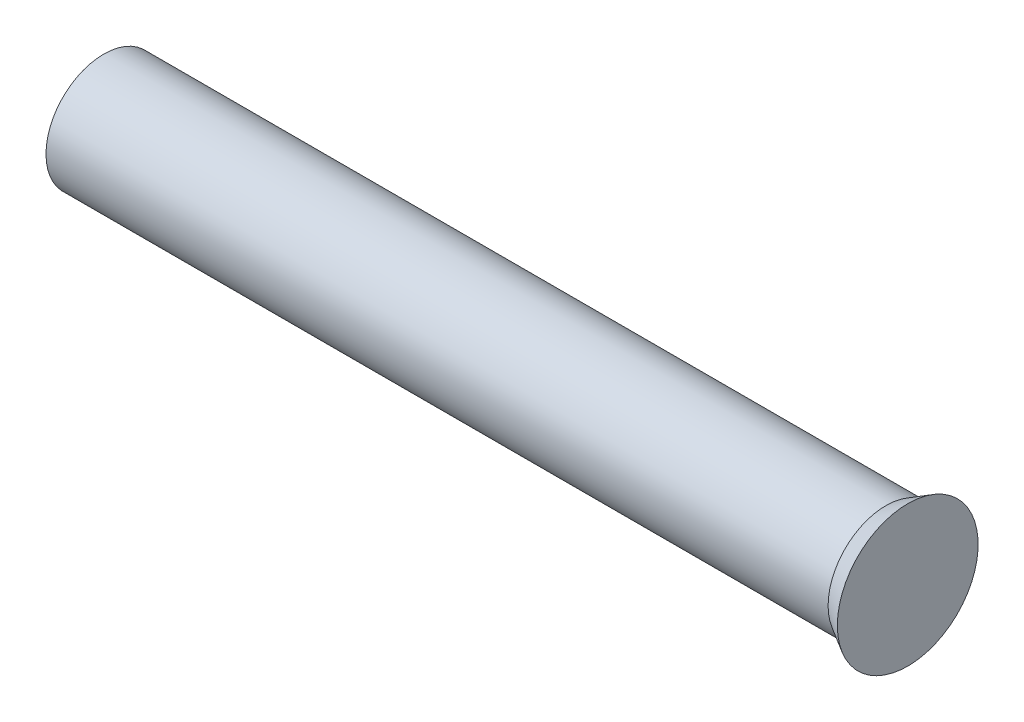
SolidWorks part; units mm, degrees
ref_plane "Front Plane" through (0, 0, 0) normal (0, 0, 1) x (1, 0, 0)
ref_plane "Top Plane" through (0, 0, 0) normal (0, 1, 0) x (1, 0, 0)
ref_plane "Right Plane" through (0, 0, 0) normal (1, 0, 0) x (0, 0, -1)
sketch "Sketch1" plane through (0, 0, 0) normal (0, 0, 1) x (1, 0, 0)
  line L0 (0, 0) -> (19.812, 0)
  line L1 (19.812, 0) -> (19.812, 1.702)
  line L2 (0, 0) -> (0, 1.397) construction
  line L3 (19.812, 1.702) -> (19.2837, 1.397)
  line L4 (19.2837, 1.397) -> (0.3743, 1.397)
  line L5 (0, 1.397) -> (0.3743, 1.397) construction
  arc A0 (0.3743, 1.397) -> (0, 0) centre (2.794, 0) ccw
  dimension "D2" = 19.812
  dimension "D5" = 5.588
  dimension "D1" = 1.702
  dimension "D3" = 1.397
  dimension "D4" = 30
revolve "Revolve1" add sketch "Sketch1" angle 360 about L0
